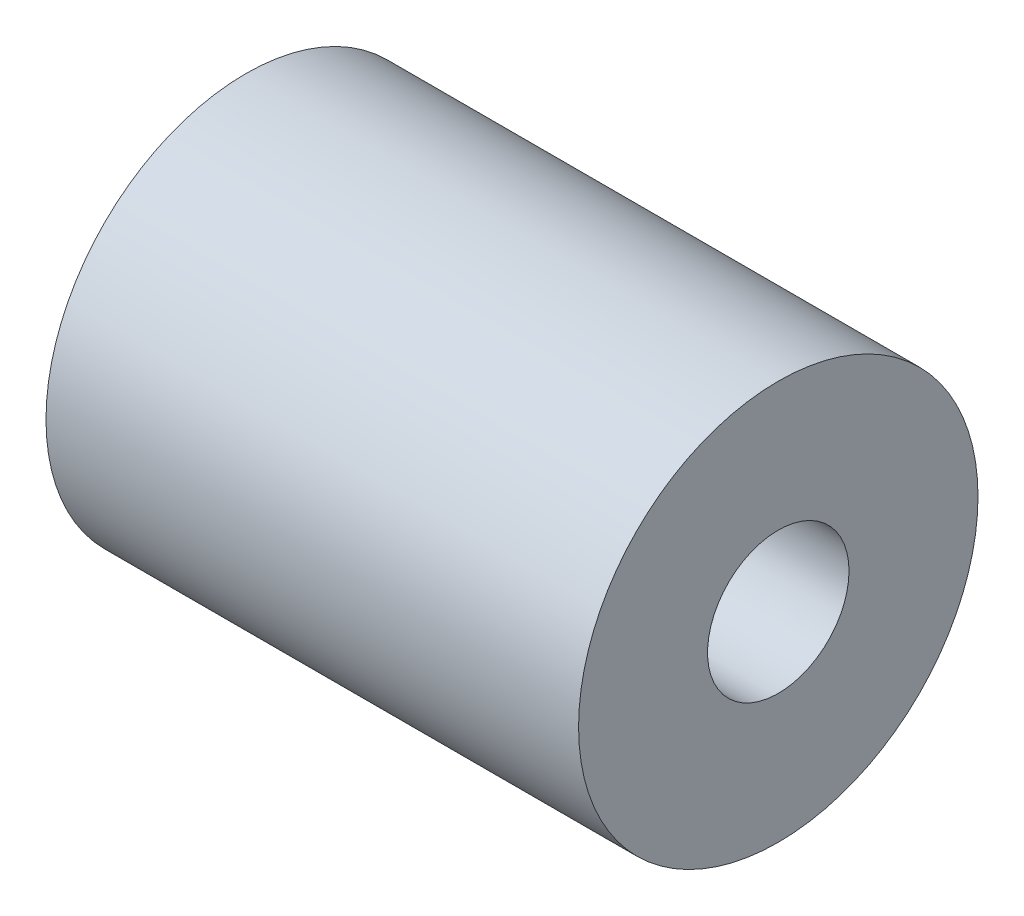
SolidWorks part; units mm, degrees
ref_plane "Front" through (0, 0, 0) normal (0, 0, 1) x (1, 0, 0)
ref_plane "Top" through (0, 0, 0) normal (0, 1, 0) x (1, 0, 0)
ref_plane "Right" through (0, 0, 0) normal (1, 0, 0) x (0, 0, -1)
sketch "Sketch1" plane through (0, 0, 0) normal (1, 0, 0) x (0, 0, -1)
  circle A0 centre (0, 0) radius 9.525
  circle A1 centre (0, 0) radius 3.3731
  dimension "D1" = 19.05
  dimension "D2" = 6.7462
extrude "Extrude1" add sketch "Sketch1" along normal blind 25.4
